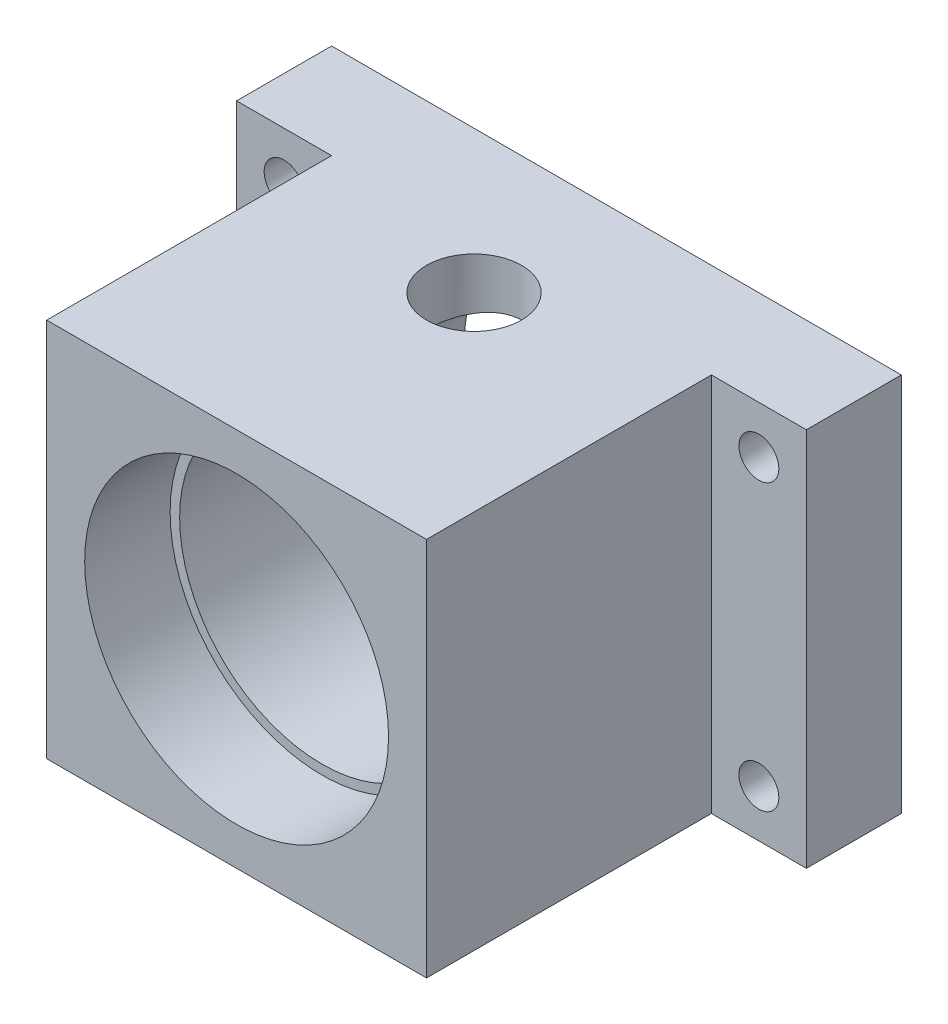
SolidWorks part; units mm, degrees
ref_plane "前视基准面" through (0, 0, 0) normal (0, 0, 1) x (1, 0, 0)
ref_plane "上视基准面" through (0, 0, 0) normal (0, 1, 0) x (1, 0, 0)
ref_plane "右视基准面" through (0, 0, 0) normal (1, 0, 0) x (0, 0, -1)
sketch "草图1" plane through (0, 0, 0) normal (0, 0, 1) x (1, 0, 0)
  line L0 (0, 0) -> (60, 0)
  line L1 (0, 40) -> (60, 40)
  line L2 (0, 0) -> (0, 40)
  line L3 (60, 0) -> (60, 40)
  circle A0 centre (30, 20) radius 15
  circle A1 centre (5, 35) radius 2.1
  circle A2 centre (5, 5) radius 2.1
  circle A3 centre (55, 5) radius 2.1
  circle A4 centre (55, 35) radius 2.1
extrude "凸台-拉伸1" add sketch "草图1" along normal blind 40
sketch "草图2" plane through (0, 40, 0) normal (0, 1, 0) x (1, 0, 0)
  line L0 (50, -10) -> (60, -10)
  line L1 (0, -10) -> (10, -10)
  line L2 (10, -40) -> (50, -40)
  line L3 (0, 0) -> (60, 0)
  line L4 (60, -10) -> (60, 0)
  line L5 (0, -10) -> (0, 0)
  line L6 (10, -40) -> (10, -10)
  line L7 (50, -40) -> (50, -10)
extrude "切除-拉伸1" cut sketch "草图2" against normal blind 40 flip side to cut
sketch "草图3" plane through (0, 40, 0) normal (0, 1, 0) x (1, 0, 0)
  circle A0 centre (30, -15) radius 5
extrude "切除-拉伸2" cut sketch "草图3" against normal up to next
sketch "草图4" plane through (0, 0, 40) normal (0, 0, 1) x (1, 0, 0)
  circle A0 centre (30, 20) radius 16
extrude "切除-拉伸3" cut sketch "草图4" against normal blind 9
sketch "草图5" plane through (0, 0, 0) normal (0, 0, -1) x (-1, 0, 0)
  circle A0 centre (-30, 20) radius 16
extrude "切除-拉伸4" cut sketch "草图5" against normal blind 9
